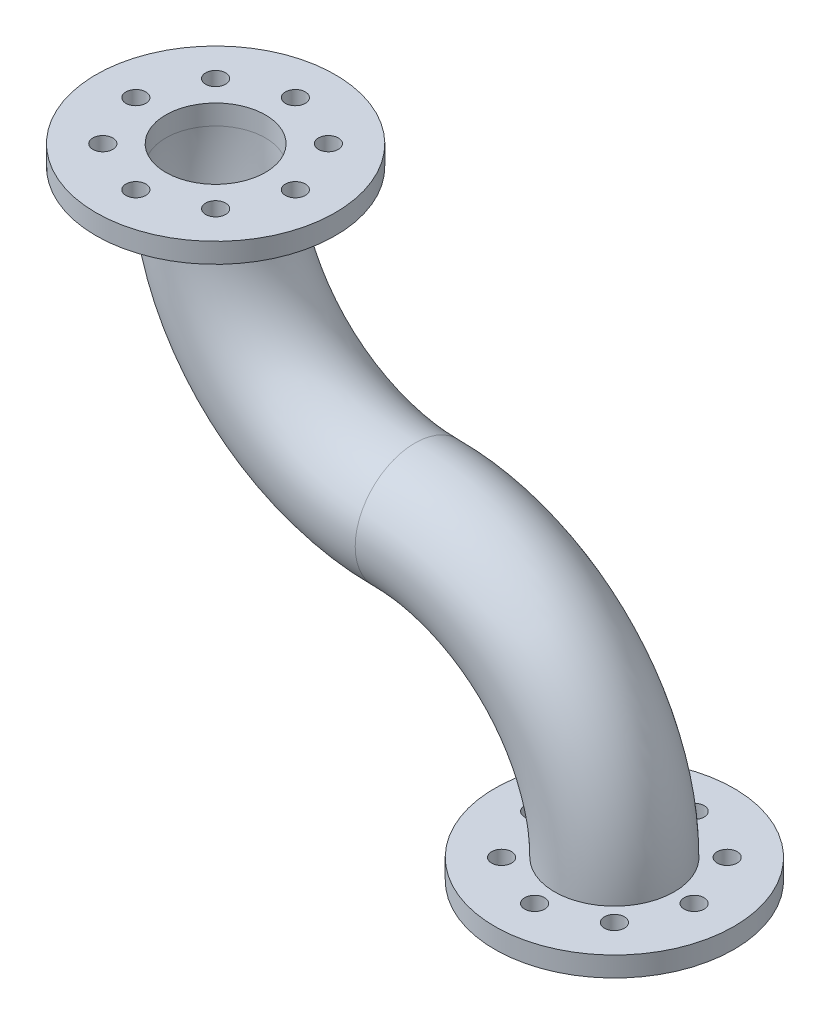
SolidWorks part; units mm, degrees
ref_plane "Front" through (0, 0, 0) normal (0, 0, 1) x (1, 0, 0)
ref_plane "Top" through (0, 0, 0) normal (0, 1, 0) x (1, 0, 0)
ref_plane "Right" through (0, 0, 0) normal (1, 0, 0) x (0, 0, -1)
sketch "Sketch1" plane through (0, 0, 0) normal (0, 0, 1) x (1, 0, 0)
  arc A0 (-50, 0) -> (0, -50) centre (0, 0) ccw
  arc A1 (0, -50) -> (50, -100) centre (0, -100) cw
  dimension "D1" = 50
sketch "Sketch2" plane through (0, 0, 0) normal (0, 1, 0) x (1, 0, 0)
  circle A0 centre (-50, 0) radius 15
  circle A1 centre (-50, 0) radius 12.5
  dimension "D1" = 30
  dimension "D2" = 25
sweep "Sweep1" add profiles "Sketch2" path "Sketch1"
sketch "Sketch3" plane through (0, 0, 0) normal (0, 1, 0) x (-1, 0, 0)
  circle A0 centre (50, 0) radius 12.5 construction
  circle A1 centre (50, 0) radius 12.5
  circle A2 centre (50, 0) radius 30
  dimension "D1" = 60
extrude "Extrude2" add sketch "Sketch3" along normal blind 5
sketch "Sketch4" plane through (-13.6848, -100, 2.0941) normal (0, -1, 0) x (1, 0, 0)
  circle A1 centre (63.6848, -2.0941) radius 12.5
  circle A2 centre (63.6848, -2.0941) radius 30
  circle A3 centre (63.6848, -2.0941) radius 15 construction
  dimension "D1" = 60
extrude "Extrude3" add sketch "Sketch4" along normal blind 5
sketch "Sketch5" plane through (0, 5, 0) normal (0, 1, 0) x (-1, 0, 0)
  circle A1 centre (50, 0) radius 30 construction
  point P0 (70, 0)
  dimension "D1" = 20
other "Hole1"
sketch "Sketch6" plane through (0, 5, 0) normal (0, 1, 0) x (-1, 0, 0)
  circle A0 centre (70, 0) radius 2.5
  dimension "D1" = 5
pattern_circular "CirPattern1" count 8 over 360 about axis through (-50, 0, 0) along (0, 1, 0) of "Hole1"
sketch "Sketch7" plane through (143.2655, -100, 1.6299) normal (0, 1, 0) x (-1, 0, 0)
  circle A0 centre (73.2655, -1.6299) radius 2.5
  dimension "D1" = 5
  dimension "D2" = 20
other "Hole2"
pattern_circular "CirPattern2" count 8 over 360 about axis through (50, 0, 0) along (0, 1, 0) of "Hole2"
